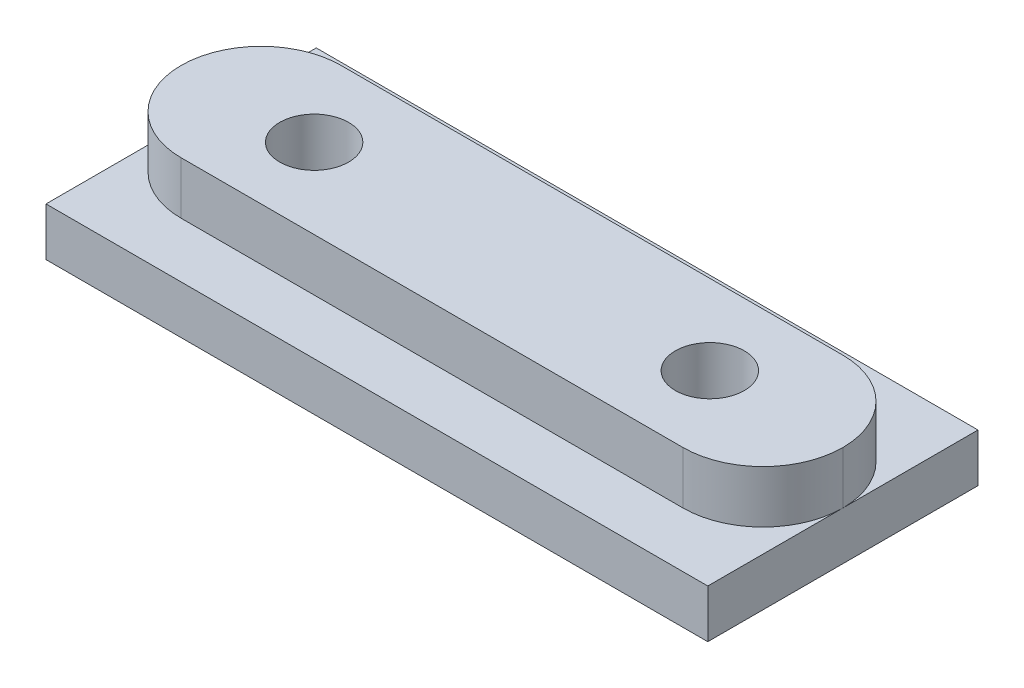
SolidWorks part; units mm, degrees
ref_plane "Front Plane" through (0, 0, 0) normal (0, 0, 1) x (1, 0, 0)
ref_plane "Top Plane" through (0, 0, 0) normal (0, 1, 0) x (1, 0, 0)
ref_plane "Right Plane" through (0, 0, 0) normal (1, 0, 0) x (0, 0, -1)
sketch "Sketch1" plane through (0, 0, 0) normal (1, 0, 0) x (0, 0, -1)
  line L0 (0, 0) -> (9.8, 0)
  line L1 (9.8, 0) -> (9.8, 1.75)
  line L2 (0, 1.75) -> (2, 1.75)
  line L3 (2, 1.75) -> (2, 3.65)
  line L4 (2, 3.65) -> (7.8, 3.65)
  line L5 (7.8, 3.65) -> (7.8, 1.75)
  line L6 (7.8, 1.75) -> (9.8, 1.75)
  line L7 (0, 1.75) -> (0, 0)
  dimension "D1" = 5.8
  dimension "D2" = 9.8
  dimension "D3" = 1.75
  dimension "D4" = 1.9
extrude "Boss-Extrude1" add sketch "Sketch1" along normal blind 24
hole_wizard "M3x0.5 Tapped Hole1" positions "Sketch3" profile "Sketch2" tap size "M3x0.5" standard "ANSI Metric"
sketch "Sketch3" plane through (0, 3.65, 0) normal (0, 1, 0) x (1, 0, 0)
  line L0 (4.825, 4.9) -> (19.175, 4.9) construction
  line L2 (4.825, 4.9) -> (0, 4.9) construction
  line L3 (0, 7.8) -> (0, 2) construction
  line L6 (19.175, 4.9) -> (24, 4.9) construction
  line L7 (24, 7.8) -> (24, 2) construction
  point P0 (4.825, 4.9)
  point P2 (19.175, 4.9)
  dimension "D1" = 14.35
sketch "Sketch2" plane through (4.825, 3.65, -4.9) normal (1, 0, 0) x (0, 0, 1)
  line L0 (0, 0) -> (0, 3.65)
  line L1 (0, 3.65) -> (1.25, 3.65)
  line L2 (1.25, 3.65) -> (1.25, 0)
  line L5 (1.25, 0) -> (0, 0)
  line L11 (0, -6.35) -> (0, 107.95) construction
  dimension "Thru Tap Drill Dia." = 2.5
  dimension "Thru Tap Drill Depth" = 3.65
fillet "Fillet1" radius 2.9 4 edges at (0, 2.7, -7.8) (0, 2.7, -2) (24, 2.7, -7.8) (24, 2.7, -2)
